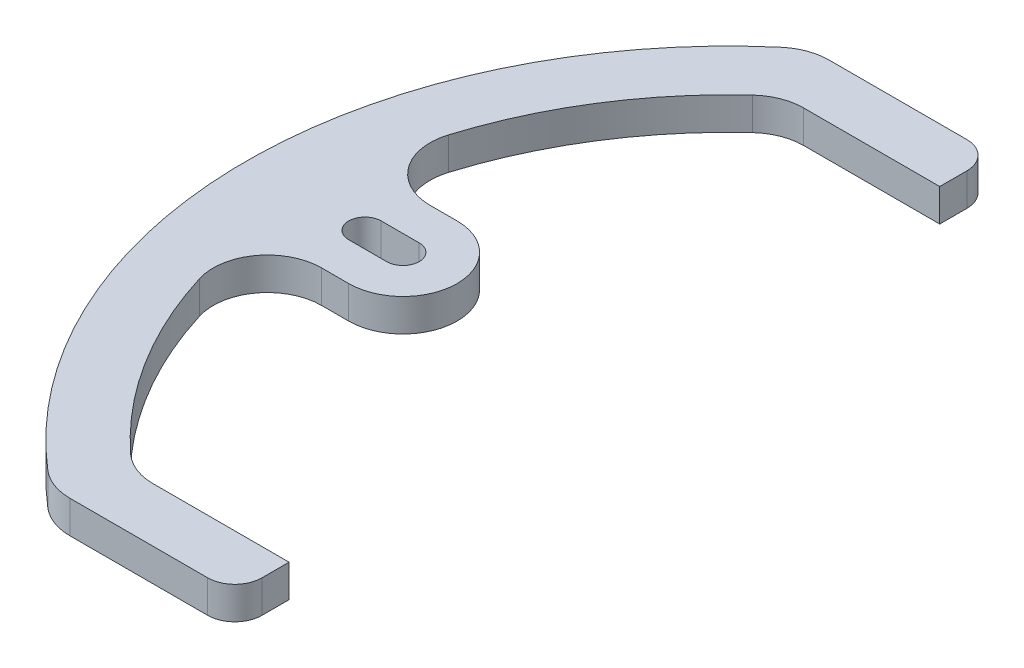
SolidWorks part; units mm, degrees
ref_plane "Plan de face" through (0, 0, 0) normal (0, 0, 1) x (1, 0, 0)
ref_plane "Plan de dessus" through (0, 0, 0) normal (0, 1, 0) x (1, 0, 0)
ref_plane "Plan de droite" through (0, 0, 0) normal (1, 0, 0) x (0, 0, -1)
sketch "Esquisse1" plane through (0, 0, 0) normal (0, 1, 0) x (1, 0, 0)
  line L0 (-111.0793, 0) -> (144.6389, 0) construction
  line L1 (-75, 10) -> (-79.9923, 10)
  line L2 (-61.0869, 60) -> (-36, 60)
  line L3 (-36, 60) -> (-36, 65)
  line L4 (-66.3907, 70) -> (-41, 70)
  line L5 (-82, 79.8205) -> (-82, -51.6438) construction
  line L6 (-82, 3) -> (-75, 3)
  line L7 (-75, -3) -> (-82, -3)
  line L27 (-72.5, -38.6395) -> (-72.5, -16.737) construction
  line L35 (-95, 32.0044) -> (-95, -4) construction
  line L45 (-104, -14.8384) -> (-104, 14.0513) construction
  line L46 (-15, -60) -> (-80, -60) construction
  line L47 (-80, -70) -> (-15, -70) construction
  line L48 (-36, -53.4566) -> (-36, -79.5019) construction
  line L49 (-75, -17.817) -> (-75, 25.6996) construction
  line L50 (-63.0243, -10) -> (-97.961, -10) construction
  line L51 (-75, -10) -> (-79.9923, -10)
  line L52 (-66.3907, -70) -> (-41, -70)
  line L54 (-36, -60) -> (-36, -65)
  line L55 (-61.0869, -60) -> (-36, -60)
  arc A0 (-89.55, 22.9412) -> (-79.9923, 10) centre (-79.9923, 20) ccw
  arc A1 (-89.55, 22.9412) -> (-67.8644, 57.3529) centre (-15, 0) cw
  arc A2 (-67.8644, 57.3529) -> (-61.0869, 60) centre (-61.0869, 50) cw
  arc A3 (-41, 70) -> (-36, 65) centre (-41, 65) cw
  arc A4 (-66.3907, 70) -> (-72.8958, 67.5949) centre (-66.3907, 60) ccw
  circle A22 centre (-80, 0) radius 9 construction
  arc A27 (-89.55, -22.9412) -> (-67.8644, -57.3529) centre (-15, 0) ccw
  arc A28 (-89.55, -22.9412) -> (-79.9923, -10) centre (-79.9923, -20) cw
  arc A29 (-67.8644, -57.3529) -> (-61.0869, -60) centre (-61.0869, -50) ccw
  arc A30 (-75, -10) -> (-75, 10) centre (-75, 0) ccw
  arc A31 (-72.8958, 67.5949) -> (-72.8958, -67.5949) centre (-15, 0) ccw
  arc A32 (-41, -70) -> (-36, -65) centre (-41, -65) ccw
  arc A33 (-66.3907, -70) -> (-72.8958, -67.5949) centre (-66.3907, -60) cw
  arc A34 (-75, -3) -> (-75, 3) centre (-75, 0) ccw
  arc A35 (-82, 3) -> (-82, -3) centre (-82, 0) ccw
  point P154 (-64.8397, -60)
  point P159 (-92.3563, -10)
  point P165 (-36, -70)
  point P168 (-69.9636, -70)
  dimension "D38" = 10
  dimension "D40" = 10
  dimension "D41" = 5
  dimension "D42" = 10
  dimension "D35" = 20
  dimension "D36" = 10
  dimension "D39" = 10
extrude "Extrusion1" add sketch "Esquisse1" along normal blind 6
